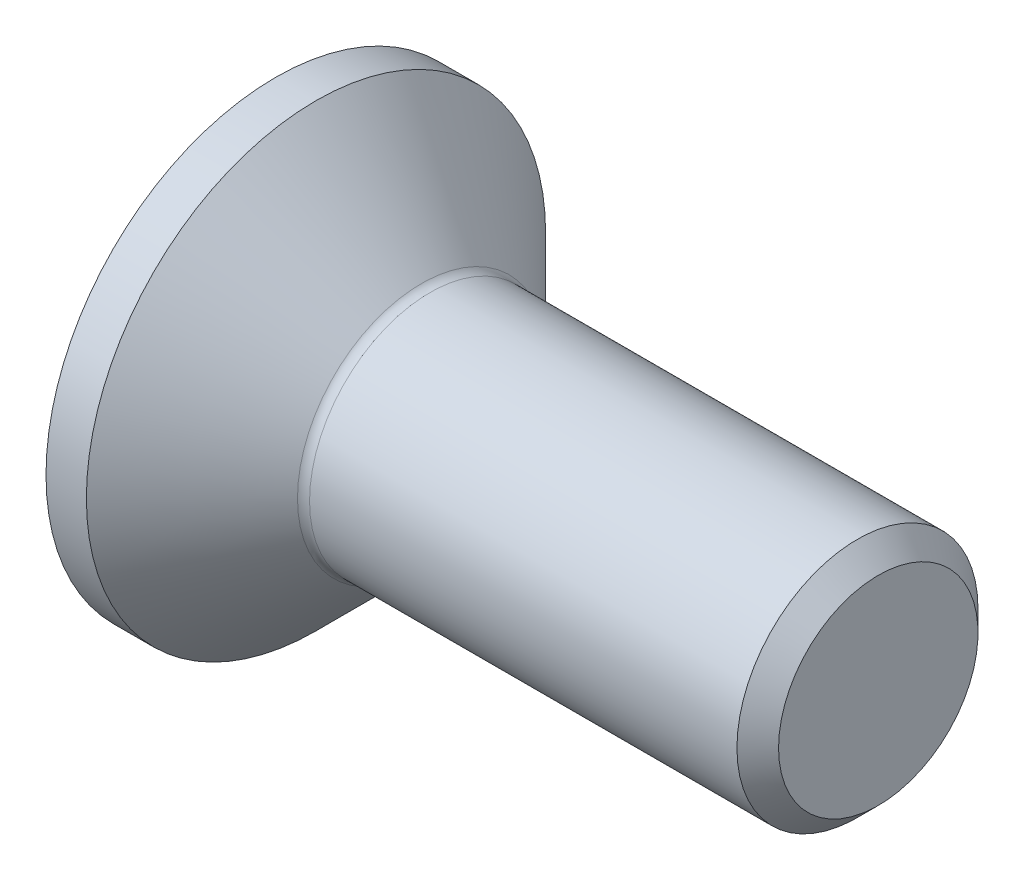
SolidWorks part; units mm, degrees
ref_plane "Plane1" through (0, 0, 0) normal (0, 0, 1) x (1, 0, 0)
ref_plane "Plane2" through (0, 0, 0) normal (0, 1, 0) x (1, 0, 0)
ref_plane "Plane3" through (0, 0, 0) normal (1, 0, 0) x (0, 0, -1)
sketch "BodySke" plane through (0, 0, 0) normal (0, 0, 1) x (1, 0, 0)
  line L0 (0, 0) -> (0, 7.62)
  line L1 (1.34, 7.62) -> (4.96, 4)
  line L2 (0, 7.62) -> (1.34, 7.62)
  line L3 (4.96, 4) -> (19.3095, 4)
  line L4 (20, 3.3095) -> (20, 0)
  line L5 (20, 0) -> (0, 0)
  line L6 (0, 0) -> (127, 0) construction
  line L7 (1.34, -7.62) -> (4.96, -4) construction
  line L8 (20, 3.3095) -> (19.3095, 4)
  line L9 (0, -7.62) -> (1.34, -7.62) construction
  line L10 (20, -3.3095) -> (19.3095, -4) construction
  line L11 (6.21, 10.35) -> (6.21, -11.875) construction
  line L12 (0, 19.05) -> (0, -3.175) construction
  dimension "D1" = 1.34
  dimension "Diameter" = 8
  dimension "Head_ht" = 4.96
  dimension "Length" = 20
  dimension "Body_ch_ang" = 45
  dimension "Head_dia" = 15.24
  dimension "Minor_dia" = 6.619
  dimension "Head_ang" = 90
  dimension "Advance" = 1.25
  dimension "Thread_nom" = 20
revolve "BaseBody" add sketch "BodySke"
fillet "Fillet1" radius 0.4 1 edges at (4.96, 0, 4)
sketch "Sketch2" plane through (0, 0, 0) normal (0, 0, 1) x (1, 0, 0)
  line L0 (0, 2.5) -> (3, 2.5)
  line L1 (3, 2.5) -> (4.4434, 0)
  line L2 (0, 0) -> (127, 0) construction
  line L3 (4.4434, 0) -> (0, 0)
  line L4 (0, 0) -> (0, 2.5)
  line L5 (0, -2.5) -> (3, -2.5) construction
  line L6 (0, 0) -> (47.625, 0) construction
  line L8 (0, 7.62) -> (0, -7.62) construction
  dimension "D2" = 60
  dimension "PreBroach_depth" = 3
  dimension "PreBroach_dia" = 5
revolve "PreBroach" cut sketch "Sketch2" angle 360 about L6
sketch "Sketch3" plane through (0, 0, 0) normal (-1, 0, 0) x (0, 0, 1)
  line L0 (-2.5, -1.4434) -> (-2.5, 1.4434)
  line L1 (-2.5, 1.4434) -> (0, 2.8868)
  line L2 (0, 2.8868) -> (2.5, 1.4434)
  line L3 (2.5, 1.4434) -> (2.5, -1.4434)
  line L4 (2.5, -1.4434) -> (0, -2.8868)
  line L5 (0, -2.8868) -> (-2.5, -1.4434)
  dimension "D1" = 2.5
  dimension "D2" = 2.5
  dimension "D3" = 5
  dimension "Hex_size" = 5
extrude "Hex" cut sketch "Sketch3" against normal blind 3
sketch "ThdSchSke" plane through (0, 0, 0) normal (0, 0, 1) x (1, 0, 0)
  line L0 (8.71, -3.3095) -> (8.2265, -4)
  line L1 (8.71, -3.3095) -> (9.1935, -4)
  line L2 (9.1935, -4) -> (9.1935, -5)
  line L3 (-3.175, 0) -> (5.1513, 0) construction
  line L4 (0, 7.62) -> (0, -7.62) construction
  line L5 (9.1935, -5) -> (8.2265, -5)
  line L6 (8.2265, -5) -> (8.2265, -4)
  dimension "Thread_minor" = 6.619
  dimension "Diameter" = 8
  dimension "Start" = 8.71
  dimension "SideAngle" = 55
  dimension "VeeAngle" = 70
  dimension "Overcut" = 10
revolve "ThreadSchematic" [suppressed] cut sketch "ThdSchSke" angle 360 about L3
pattern_linear "ThdSchPat" [suppressed]
equation "\"Thread_minor@ThreadCosmetic\"  =  \"Minor_dia@BodySke\""
equation "\"D1@Sketch3\" = \"Hex_size@Sketch3\" / 2"
equation "\"D2@Sketch3\" = \"D1@Sketch3\""
equation "\"D3@Sketch3\" = \"Hex_size@Sketch3\""
equation "\"Thread_length@ThreadCosmetic\" = ((sgn( (\"Length@BodySke\" - \"Advance@BodySke\" * 3.0 - \"Head_ht@BodySke\" ) - \"Thread_nom@BodySke\" )-1)*( (\"Length@BodySke\" - \"Advance@BodySke\" * 3.0 - \"Head_ht@BodySke\" "
equation "\"Thread_minor@ThdSchSke\" = \"Minor_dia@BodySke\""
equation "\"Diameter@ThdSchSke\" = \"Diameter@BodySke\""
equation "\"Overcut@ThdSchSke\" = \"Diameter@BodySke\" * 1.25"
equation "\"Start@ThdSchSke\" = 0.000001 + \"Length@BodySke\" - \"Thread_length@ThreadCosmetic\"  '---Countersunk---"
equation "\"Num_threads@ThdSchPat\" = int( \"Thread_length@ThreadCosmetic\" / \"Advance@BodySke\" + 0.999 )  + 1"
equation "\"Advance@ThdSchPat\" = \"Thread_length@ThreadCosmetic\" /  (\"Num_threads@ThdSchPat\" - 1) 'relax it"
equation "\"Num_threads@ThdSchPat\" = \"Num_threads@ThdSchPat\" - sgn( \"Num_threads@ThdSchPat\" - 1) '---chamfered tips only---"
